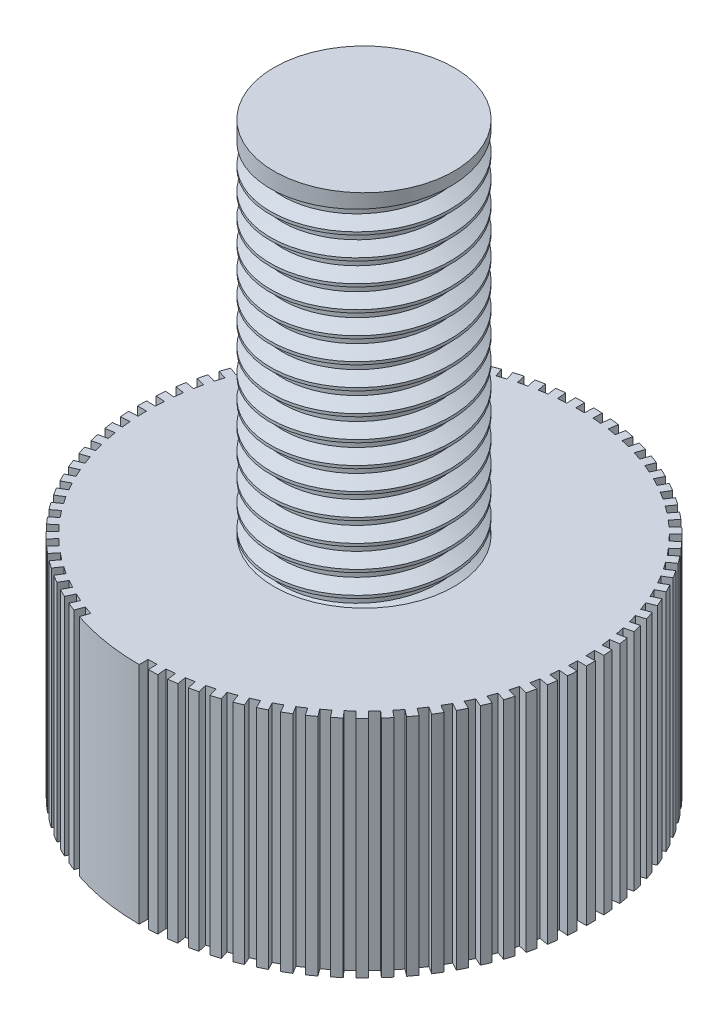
SolidWorks part; units mm, degrees
ref_plane "Front Plane" through (0, 0, 0) normal (0, 0, 1) x (1, 0, 0)
ref_plane "Top Plane" through (0, 0, 0) normal (0, 1, 0) x (1, 0, 0)
ref_plane "Right Plane" through (0, 0, 0) normal (1, 0, 0) x (0, 0, -1)
sketch "Sketch1" plane through (0, 0, 0) normal (0, 1, 0) x (1, 0, 0)
  circle A0 centre (0, 0) radius 6.35
extrude "Boss-Extrude1" add sketch "Sketch1" along normal blind 6.35
ref_plane "Plane1" through (0, 0, 6.35) normal (0, 0, 1) x (1, 0, 0)
sketch "Sketch2" plane through (0, 0, 6.35) normal (0, 0, 1) x (1, 0, 0)
  line L0 (0.508, 6.35) -> (0.508, 0)
  line L1 (0, 6.35) -> (0.254, 6.35)
  line L2 (0, 6.35) -> (0, 0)
  line L3 (0, 0) -> (0.254, 0)
  line L4 (0.254, 6.35) -> (0.254, 0)
  line L5 (0.508, 6.35) -> (0.762, 6.35)
  line L6 (0.508, 0) -> (0.762, 0)
  line L7 (0.762, 6.35) -> (0.762, 0)
  line L8 (1.016, 6.35) -> (1.016, 0)
  line L9 (1.016, 6.35) -> (1.27, 6.35)
  line L10 (1.016, 0) -> (1.27, 0)
  line L11 (1.27, 6.35) -> (1.27, 0)
  line L12 (1.524, 6.35) -> (1.524, 0)
  line L13 (1.524, 6.35) -> (1.778, 6.35)
  line L14 (1.524, 0) -> (1.778, 0)
  line L15 (1.778, 6.35) -> (1.778, 0)
  line L16 (2.032, 6.35) -> (2.032, 0)
  line L17 (2.032, 6.35) -> (2.286, 6.35)
  line L18 (2.032, 0) -> (2.286, 0)
  line L19 (2.286, 6.35) -> (2.286, 0)
  line L20 (2.54, 6.35) -> (2.54, 0)
  line L21 (2.54, 6.35) -> (2.794, 6.35)
  line L22 (2.54, 0) -> (2.794, 0)
  line L23 (2.794, 6.35) -> (2.794, 0)
  line L24 (3.048, 6.35) -> (3.048, 0)
  line L25 (3.048, 6.35) -> (3.302, 6.35)
  line L26 (3.048, 0) -> (3.302, 0)
  line L27 (3.302, 6.35) -> (3.302, 0)
  line L28 (3.5559, 6.35) -> (3.5559, 0)
  line L29 (3.5559, 6.35) -> (3.8099, 6.35)
  line L30 (3.5559, 0) -> (3.8099, 0)
  line L31 (3.8099, 6.35) -> (3.8099, 0)
  line L32 (4.0639, 6.35) -> (4.0639, 0)
  line L33 (4.0639, 6.35) -> (4.3179, 6.35)
  line L34 (4.0639, 0) -> (4.3179, 0)
  line L35 (4.3179, 6.35) -> (4.3179, 0)
  line L36 (4.5719, 6.35) -> (4.5719, 0)
  line L37 (4.5719, 6.35) -> (4.8259, 6.35)
  line L38 (4.5719, 0) -> (4.8259, 0)
  line L39 (4.8259, 6.35) -> (4.8259, 0)
  line L40 (5.0799, 6.35) -> (5.0799, 0)
  line L41 (5.0799, 6.35) -> (5.3339, 6.35)
  line L42 (5.0799, 0) -> (5.3339, 0)
  line L43 (5.3339, 6.35) -> (5.3339, 0)
  line L44 (5.5879, 6.35) -> (5.5879, 0)
  line L45 (5.5879, 6.35) -> (5.8419, 6.35)
  line L46 (5.5879, 0) -> (5.8419, 0)
  line L47 (5.8419, 6.35) -> (5.8419, 0)
  line L48 (6.0959, 6.35) -> (6.0959, 0)
  line L49 (6.0959, 6.35) -> (6.3499, 6.35)
  line L50 (6.0959, 0) -> (6.3499, 0)
  line L51 (6.3499, 6.35) -> (6.3499, 0)
  line L52 (6.6039, 6.35) -> (6.6039, 0)
  line L53 (6.6039, 6.35) -> (6.8579, 6.35)
  line L54 (6.6039, 0) -> (6.8579, 0)
  line L55 (6.8579, 6.35) -> (6.8579, 0)
  line L56 (7.1119, 6.35) -> (7.1119, 0)
  line L57 (7.1119, 6.35) -> (7.3659, 6.35)
  line L58 (7.1119, 0) -> (7.3659, 0)
  line L59 (7.3659, 6.35) -> (7.3659, 0)
  line L60 (7.6199, 6.35) -> (7.6199, 0)
  line L61 (7.6199, 6.35) -> (7.8739, 6.35)
  line L62 (7.6199, 0) -> (7.8739, 0)
  line L63 (7.8739, 6.35) -> (7.8739, 0)
  line L64 (8.1279, 6.35) -> (8.1279, 0)
  line L65 (8.1279, 6.35) -> (8.3819, 6.35)
  line L66 (8.1279, 0) -> (8.3819, 0)
  line L67 (8.3819, 6.35) -> (8.3819, 0)
  line L68 (8.6359, 6.35) -> (8.6359, 0)
  line L69 (8.6359, 6.35) -> (8.8899, 6.35)
  line L70 (8.6359, 0) -> (8.8899, 0)
  line L71 (8.8899, 6.35) -> (8.8899, 0)
  line L72 (9.1439, 6.35) -> (9.1439, 0)
  line L73 (9.1439, 6.35) -> (9.3979, 6.35)
  line L74 (9.1439, 0) -> (9.3979, 0)
  line L75 (9.3979, 6.35) -> (9.3979, 0)
  line L76 (9.6518, 6.35) -> (9.6518, 0)
  line L77 (9.6518, 6.35) -> (9.9058, 6.35)
  line L78 (9.6518, 0) -> (9.9058, 0)
  line L79 (9.9058, 6.35) -> (9.9058, 0)
  line L80 (10.1598, 6.35) -> (10.1598, 0)
  line L81 (10.1598, 6.35) -> (10.4138, 6.35)
  line L82 (10.1598, 0) -> (10.4138, 0)
  line L83 (10.4138, 6.35) -> (10.4138, 0)
  line L84 (10.6678, 6.35) -> (10.6678, 0)
  line L85 (10.6678, 6.35) -> (10.9218, 6.35)
  line L86 (10.6678, 0) -> (10.9218, 0)
  line L87 (10.9218, 6.35) -> (10.9218, 0)
  line L88 (11.1758, 6.35) -> (11.1758, 0)
  line L89 (11.1758, 6.35) -> (11.4298, 6.35)
  line L90 (11.1758, 0) -> (11.4298, 0)
  line L91 (11.4298, 6.35) -> (11.4298, 0)
  line L92 (11.6838, 6.35) -> (11.6838, 0)
  line L93 (11.6838, 6.35) -> (11.9378, 6.35)
  line L94 (11.6838, 0) -> (11.9378, 0)
  line L95 (11.9378, 6.35) -> (11.9378, 0)
  line L96 (12.1918, 6.35) -> (12.1918, 0)
  line L97 (12.1918, 6.35) -> (12.4458, 6.35)
  line L98 (12.1918, 0) -> (12.4458, 0)
  line L99 (12.4458, 6.35) -> (12.4458, 0)
  line L100 (12.6998, 6.35) -> (12.6998, 0)
  line L101 (12.6998, 6.35) -> (12.9538, 6.35)
  line L102 (12.6998, 0) -> (12.9538, 0)
  line L103 (12.9538, 6.35) -> (12.9538, 0)
  line L104 (13.2078, 6.35) -> (13.2078, 0)
  line L105 (13.2078, 6.35) -> (13.4618, 6.35)
  line L106 (13.2078, 0) -> (13.4618, 0)
  line L107 (13.4618, 6.35) -> (13.4618, 0)
  line L108 (13.7158, 6.35) -> (13.7158, 0)
  line L109 (13.7158, 6.35) -> (13.9698, 6.35)
  line L110 (13.7158, 0) -> (13.9698, 0)
  line L111 (13.9698, 6.35) -> (13.9698, 0)
  line L112 (14.2238, 6.35) -> (14.2238, 0)
  line L113 (14.2238, 6.35) -> (14.4778, 6.35)
  line L114 (14.2238, 0) -> (14.4778, 0)
  line L115 (14.4778, 6.35) -> (14.4778, 0)
  line L116 (14.7318, 6.35) -> (14.7318, 0)
  line L117 (14.7318, 6.35) -> (14.9858, 6.35)
  line L118 (14.7318, 0) -> (14.9858, 0)
  line L119 (14.9858, 6.35) -> (14.9858, 0)
  line L120 (15.2398, 6.35) -> (15.2398, 0)
  line L121 (15.2398, 6.35) -> (15.4938, 6.35)
  line L122 (15.2398, 0) -> (15.4938, 0)
  line L123 (15.4938, 6.35) -> (15.4938, 0)
  line L124 (15.7477, 6.35) -> (15.7477, 0)
  line L125 (15.7477, 6.35) -> (16.0017, 6.35)
  line L126 (15.7477, 0) -> (16.0017, 0)
  line L127 (16.0017, 6.35) -> (16.0017, 0)
  line L128 (16.2557, 6.35) -> (16.2557, 0)
  line L129 (16.2557, 6.35) -> (16.5097, 6.35)
  line L130 (16.2557, 0) -> (16.5097, 0)
  line L131 (16.5097, 6.35) -> (16.5097, 0)
  line L132 (16.7637, 6.35) -> (16.7637, 0)
  line L133 (16.7637, 6.35) -> (17.0177, 6.35)
  line L134 (16.7637, 0) -> (17.0177, 0)
  line L135 (17.0177, 6.35) -> (17.0177, 0)
  line L136 (17.2717, 6.35) -> (17.2717, 0)
  line L137 (17.2717, 6.35) -> (17.5257, 6.35)
  line L138 (17.2717, 0) -> (17.5257, 0)
  line L139 (17.5257, 6.35) -> (17.5257, 0)
  line L140 (17.7797, 6.35) -> (17.7797, 0)
  line L141 (17.7797, 6.35) -> (18.0337, 6.35)
  line L142 (17.7797, 0) -> (18.0337, 0)
  line L143 (18.0337, 6.35) -> (18.0337, 0)
  line L144 (18.2877, 6.35) -> (18.2877, 0)
  line L145 (18.2877, 6.35) -> (18.5417, 6.35)
  line L146 (18.2877, 0) -> (18.5417, 0)
  line L147 (18.5417, 6.35) -> (18.5417, 0)
  line L148 (18.7957, 6.35) -> (18.7957, 0)
  line L149 (18.7957, 6.35) -> (19.0497, 6.35)
  line L150 (18.7957, 0) -> (19.0497, 0)
  line L151 (19.0497, 6.35) -> (19.0497, 0)
  line L152 (19.3037, 6.35) -> (19.3037, 0)
  line L153 (19.3037, 6.35) -> (19.5577, 6.35)
  line L154 (19.3037, 0) -> (19.5577, 0)
  line L155 (19.5577, 6.35) -> (19.5577, 0)
  line L156 (19.8117, 6.35) -> (19.8117, 0)
  line L157 (19.8117, 6.35) -> (20.0657, 6.35)
  line L158 (19.8117, 0) -> (20.0657, 0)
  line L159 (20.0657, 6.35) -> (20.0657, 0)
  line L160 (20.3197, 6.35) -> (20.3197, 0)
  line L161 (20.3197, 6.35) -> (20.5737, 6.35)
  line L162 (20.3197, 0) -> (20.5737, 0)
  line L163 (20.5737, 6.35) -> (20.5737, 0)
  line L164 (20.8277, 6.35) -> (20.8277, 0)
  line L165 (20.8277, 6.35) -> (21.0817, 6.35)
  line L166 (20.8277, 0) -> (21.0817, 0)
  line L167 (21.0817, 6.35) -> (21.0817, 0)
  line L168 (21.3357, 6.35) -> (21.3357, 0)
  line L169 (21.3357, 6.35) -> (21.5897, 6.35)
  line L170 (21.3357, 0) -> (21.5897, 0)
  line L171 (21.5897, 6.35) -> (21.5897, 0)
  line L172 (21.8436, 6.35) -> (21.8436, 0)
  line L173 (21.8436, 6.35) -> (22.0976, 6.35)
  line L174 (21.8436, 0) -> (22.0976, 0)
  line L175 (22.0976, 6.35) -> (22.0976, 0)
  line L176 (22.3516, 6.35) -> (22.3516, 0)
  line L177 (22.3516, 6.35) -> (22.6056, 6.35)
  line L178 (22.3516, 0) -> (22.6056, 0)
  line L179 (22.6056, 6.35) -> (22.6056, 0)
  line L180 (22.8596, 6.35) -> (22.8596, 0)
  line L181 (22.8596, 6.35) -> (23.1136, 6.35)
  line L182 (22.8596, 0) -> (23.1136, 0)
  line L183 (23.1136, 6.35) -> (23.1136, 0)
  line L184 (23.3676, 6.35) -> (23.3676, 0)
  line L185 (23.3676, 6.35) -> (23.6216, 6.35)
  line L186 (23.3676, 0) -> (23.6216, 0)
  line L187 (23.6216, 6.35) -> (23.6216, 0)
  line L188 (23.8756, 6.35) -> (23.8756, 0)
  line L189 (23.8756, 6.35) -> (24.1296, 6.35)
  line L190 (23.8756, 0) -> (24.1296, 0)
  line L191 (24.1296, 6.35) -> (24.1296, 0)
  line L192 (24.3836, 6.35) -> (24.3836, 0)
  line L193 (24.3836, 6.35) -> (24.6376, 6.35)
  line L194 (24.3836, 0) -> (24.6376, 0)
  line L195 (24.6376, 6.35) -> (24.6376, 0)
  line L196 (24.8916, 6.35) -> (24.8916, 0)
  line L197 (24.8916, 6.35) -> (25.1456, 6.35)
  line L198 (24.8916, 0) -> (25.1456, 0)
  line L199 (25.1456, 6.35) -> (25.1456, 0)
  line L200 (25.3996, 6.35) -> (25.3996, 0)
  line L201 (25.3996, 6.35) -> (25.6536, 6.35)
  line L202 (25.3996, 0) -> (25.6536, 0)
  line L203 (25.6536, 6.35) -> (25.6536, 0)
  line L204 (25.9076, 6.35) -> (25.9076, 0)
  line L205 (25.9076, 6.35) -> (26.1616, 6.35)
  line L206 (25.9076, 0) -> (26.1616, 0)
  line L207 (26.1616, 6.35) -> (26.1616, 0)
  line L208 (26.4156, 6.35) -> (26.4156, 0)
  line L209 (26.4156, 6.35) -> (26.6696, 6.35)
  line L210 (26.4156, 0) -> (26.6696, 0)
  line L211 (26.6696, 6.35) -> (26.6696, 0)
  line L212 (26.9236, 6.35) -> (26.9236, 0)
  line L213 (26.9236, 6.35) -> (27.1776, 6.35)
  line L214 (26.9236, 0) -> (27.1776, 0)
  line L215 (27.1776, 6.35) -> (27.1776, 0)
  line L216 (27.4316, 6.35) -> (27.4316, 0)
  line L217 (27.4316, 6.35) -> (27.6856, 6.35)
  line L218 (27.4316, 0) -> (27.6856, 0)
  line L219 (27.6856, 6.35) -> (27.6856, 0)
  line L220 (27.9395, 6.35) -> (27.9395, 0)
  line L221 (27.9395, 6.35) -> (28.1935, 6.35)
  line L222 (27.9395, 0) -> (28.1935, 0)
  line L223 (28.1935, 6.35) -> (28.1935, 0)
  line L224 (28.4475, 6.35) -> (28.4475, 0)
  line L225 (28.4475, 6.35) -> (28.7015, 6.35)
  line L226 (28.4475, 0) -> (28.7015, 0)
  line L227 (28.7015, 6.35) -> (28.7015, 0)
  line L228 (28.9555, 6.35) -> (28.9555, 0)
  line L229 (28.9555, 6.35) -> (29.2095, 6.35)
  line L230 (28.9555, 0) -> (29.2095, 0)
  line L231 (29.2095, 6.35) -> (29.2095, 0)
  line L232 (29.4635, 6.35) -> (29.4635, 0)
  line L233 (29.4635, 6.35) -> (29.7175, 6.35)
  line L234 (29.4635, 0) -> (29.7175, 0)
  line L235 (29.7175, 6.35) -> (29.7175, 0)
  line L236 (29.9715, 6.35) -> (29.9715, 0)
  line L237 (29.9715, 6.35) -> (30.2255, 6.35)
  line L238 (29.9715, 0) -> (30.2255, 0)
  line L239 (30.2255, 6.35) -> (30.2255, 0)
  line L240 (30.4795, 6.35) -> (30.4795, 0)
  line L241 (30.4795, 6.35) -> (30.7335, 6.35)
  line L242 (30.4795, 0) -> (30.7335, 0)
  line L243 (30.7335, 6.35) -> (30.7335, 0)
  line L244 (30.9875, 6.35) -> (30.9875, 0)
  line L245 (30.9875, 6.35) -> (31.2415, 6.35)
  line L246 (30.9875, 0) -> (31.2415, 0)
  line L247 (31.2415, 6.35) -> (31.2415, 0)
  line L248 (31.4955, 6.35) -> (31.4955, 0)
  line L249 (31.4955, 6.35) -> (31.7495, 6.35)
  line L250 (31.4955, 0) -> (31.7495, 0)
  line L251 (31.7495, 6.35) -> (31.7495, 0)
  line L252 (32.0035, 6.35) -> (32.0035, 0)
  line L253 (32.0035, 6.35) -> (32.2575, 6.35)
  line L254 (32.0035, 0) -> (32.2575, 0)
  line L255 (32.2575, 6.35) -> (32.2575, 0)
  line L256 (32.5115, 6.35) -> (32.5115, 0)
  line L257 (32.5115, 6.35) -> (32.7655, 6.35)
  line L258 (32.5115, 0) -> (32.7655, 0)
  line L259 (32.7655, 6.35) -> (32.7655, 0)
  line L260 (33.0195, 6.35) -> (33.0195, 0)
  line L261 (33.0195, 6.35) -> (33.2735, 6.35)
  line L262 (33.0195, 0) -> (33.2735, 0)
  line L263 (33.2735, 6.35) -> (33.2735, 0)
  line L264 (33.5275, 6.35) -> (33.5275, 0)
  line L265 (33.5275, 6.35) -> (33.7815, 6.35)
  line L266 (33.5275, 0) -> (33.7815, 0)
  line L267 (33.7815, 6.35) -> (33.7815, 0)
  line L268 (34.0354, 6.35) -> (34.0354, 0)
  line L269 (34.0354, 6.35) -> (34.2894, 6.35)
  line L270 (34.0354, 0) -> (34.2894, 0)
  line L271 (34.2894, 6.35) -> (34.2894, 0)
  line L272 (34.5434, 6.35) -> (34.5434, 0)
  line L273 (34.5434, 6.35) -> (34.7974, 6.35)
  line L274 (34.5434, 0) -> (34.7974, 0)
  line L275 (34.7974, 6.35) -> (34.7974, 0)
  line L276 (35.0514, 6.35) -> (35.0514, 0)
  line L277 (35.0514, 6.35) -> (35.3054, 6.35)
  line L278 (35.0514, 0) -> (35.3054, 0)
  line L279 (35.3054, 6.35) -> (35.3054, 0)
  line L280 (35.5594, 6.35) -> (35.5594, 0)
  line L281 (35.5594, 6.35) -> (35.8134, 6.35)
  line L282 (35.5594, 0) -> (35.8134, 0)
  line L283 (35.8134, 6.35) -> (35.8134, 0)
  line L284 (36.0674, 6.35) -> (36.0674, 0)
  line L285 (36.0674, 6.35) -> (36.3214, 6.35)
  line L286 (36.0674, 0) -> (36.3214, 0)
  line L287 (36.3214, 6.35) -> (36.3214, 0)
  line L288 (36.5754, 6.35) -> (36.5754, 0)
  line L289 (36.5754, 6.35) -> (36.8294, 6.35)
  line L290 (36.5754, 0) -> (36.8294, 0)
  line L291 (36.8294, 6.35) -> (36.8294, 0)
  line L292 (37.0834, 6.35) -> (37.0834, 0)
  line L293 (37.0834, 6.35) -> (37.3374, 6.35)
  line L294 (37.0834, 0) -> (37.3374, 0)
  line L295 (37.3374, 6.35) -> (37.3374, 0)
  line L296 (37.5914, 6.35) -> (37.5914, 0)
  line L297 (37.5914, 6.35) -> (37.8454, 6.35)
  line L298 (37.5914, 0) -> (37.8454, 0)
  line L299 (37.8454, 6.35) -> (37.8454, 0)
  dimension "D1" = 75
wrap "Wrap1" sketch "Sketch2" wrap type deboss source sketch "Sketch2" thickness 0.254 parameters "D1"=0.254
sketch "Sketch3" plane through (0, 6.35, 0) normal (0, 1, 0) x (1, 0, 0)
  circle A0 centre (0, 0) radius 2.54
extrude "Boss-Extrude2" add sketch "Sketch3" along normal blind 10.16
thread "Thread1" pitch 0.635 start angle 0, offset 0, length 0, pitch 0.635, diameter 5.08
ref_plane "Plane2" through (-2.54, 16.51, 0) normal (0, 0, 1) x (-1, 0, 0)
sketch "Thread Profile1" plane through (-2.54, 16.51, 0) normal (0, 0, 1) x (-1, 0, 0)
  line L0 (0, 0) -> (0, 0.635) construction
  line L11 (0, 0) -> (0, 0.5556)
  line L12 (0, 0.5556) -> (-0.3437, 0.3572)
  line L13 (-0.3437, 0.3572) -> (-0.3437, 0.1984)
  line L15 (-0.3437, 0.1984) -> (0, 0)
  line L17 (-0.3437, 0.2778) -> (0, 0.2778) construction
  point P2 (0, 0)
  dimension "Pitch" = 0.635
  dimension "Profile_Angle" = 60
  dimension "Profile_Land" = 0.1588
  dimension "Profile_Height" = 0.3437
